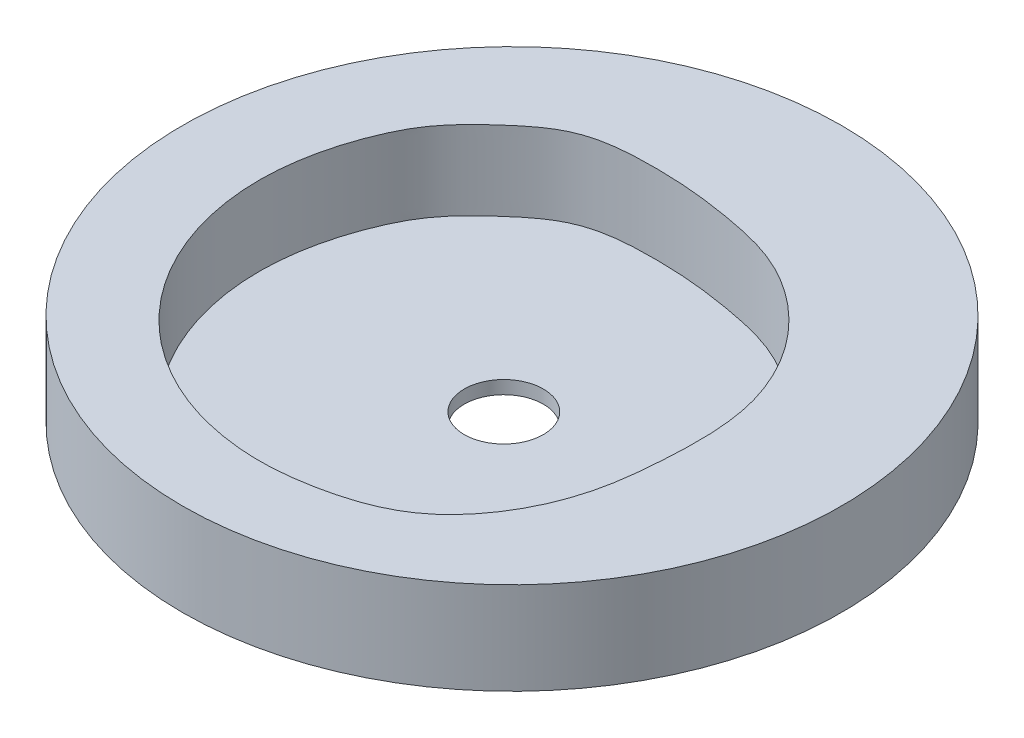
SolidWorks part; units mm, degrees
ref_plane "Płaszczyzna przednia" through (0, 0, 0) normal (0, 0, 1) x (1, 0, 0)
ref_plane "Płaszczyzna górna" through (0, 0, 0) normal (0, 1, 0) x (1, 0, 0)
ref_plane "Płaszczyzna prawa" through (0, 0, 0) normal (1, 0, 0) x (0, 0, -1)
sketch "Szkic1" plane through (0, 0, 0) normal (0, 1, 0) x (1, 0, 0)
  circle A0 centre (0, 0) radius 250
  circle A1 centre (0, -6.2065) radius 30
  dimension "D1" = 60
  dimension "D2" = 500
extrude "Dodanie-wyciągnięcie1" add sketch "Szkic1" along normal blind 70
sketch "Szkic2" plane through (0, 70, 0) normal (0, 1, 0) x (1, 0, 0)
  circle A0 centre (0, -6.2065) radius 30
  spline S0 degree 3 poles (-79.6967, -174.7191) (-43.4068, -187.0864) (-18.1883, -190.8259) (10.3969, -191.5526) (45.1783, -187.3134) (93.5059, -171.6745) (123.456, -137.1774) (139.0089, -106.5336) (148.5901, -76.4218) (153.3437, -29.76) (154.1006, 26.6914) (130.1713, 79.0407) (97.132, 114.9585) (59.616, 137.1377) (21.8361, 145.5932) (-12.7904, 150.8023) (-52.2948, 152.2755) (-96.2189, 148.9584) (-130.9145, 120.6728) (-156.6293, 95.4067) (-177.6185, 52.4714) (-189.644, -3.161) (-177.6064, -69.0452) (-150.2103, -118.1111) (-115.0823, -153.5001) (-79.6967, -174.7191) (-43.4068, -187.0864) (-18.1883, -190.8259) knots -0.112829 -0.072173 -0.028106 0 0.03355 0.041944 0.079097 0.130409 0.178137 0.200598 0.225543 0.264983 0.330361 0.378659 0.4202 0.464033 0.496717 0.52682 0.560726 0.606916 0.643458 0.681534 0.70591 0.774649 0.835102 0.887171 0.927827 0.971894 1 1.03355 1.041944 1.079097 only from (-45.0609, -185.6348) to (-45.0609, -185.6348)
extrude "Wytnij-wyciągnięcie1" cut sketch "Szkic2" against normal blind 60
